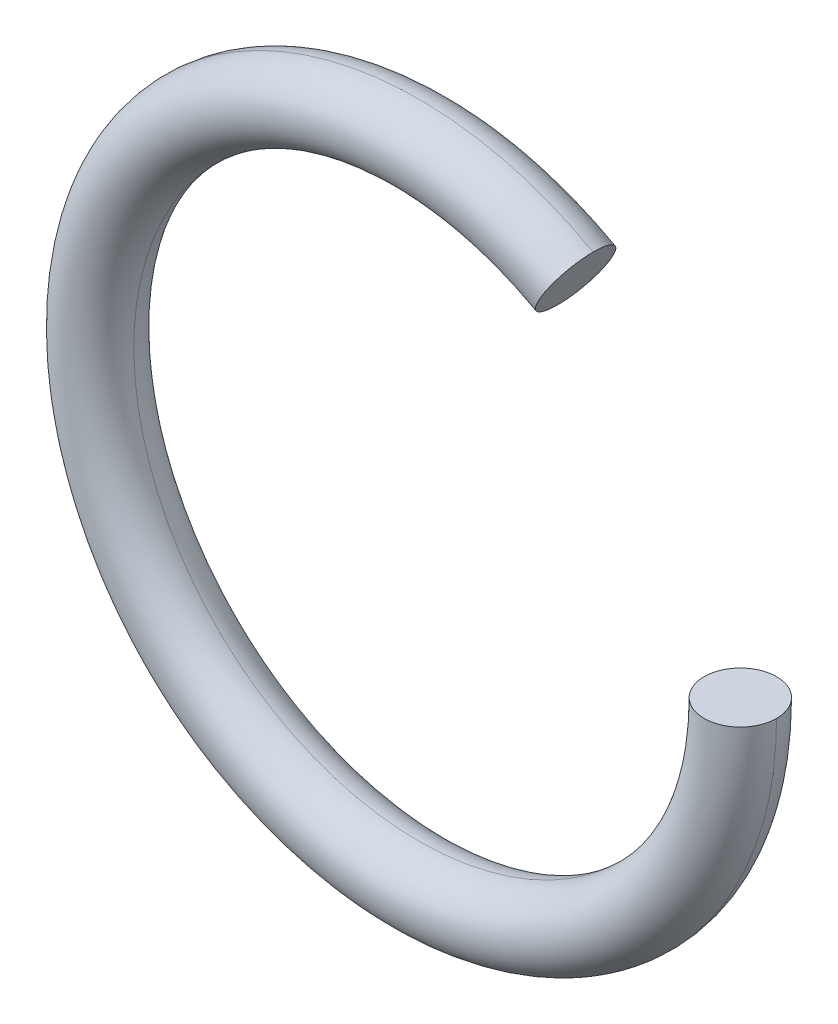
SolidWorks part; units mm, degrees
ref_plane "Front" through (0, 0, 0) normal (0, 0, 1) x (1, 0, 0)
ref_plane "Top" through (0, 0, 0) normal (0, 1, 0) x (1, 0, 0)
ref_plane "Right" through (0, 0, 0) normal (1, 0, 0) x (0, 0, -1)
other "Configuration Table"
sketch "Sketch1" plane through (0, 0, 0) normal (0, 0, 1) x (1, 0, 0)
  line L0 (0, 0) -> (28.3513, 0) construction
  line L1 (0, 0) -> (0, 38.0466) construction
  line L2 (0, 0) -> (3.5614, 6.3826) construction
  arc A0 (1.9247, 3.4494) -> (3.95, 0) centre (0, 0) ccw
  dimension "d5" = 7.9
  dimension "e" = 4
sketch "Sketch2" plane through (0, 0, 0) normal (0, 1, 0) x (1, 0, 0)
  circle A0 centre (3.55, 0) radius 0.4
  point P2 (3.95, 0)
  dimension "d4" = 0.8
sweep "Sweep1" add profiles "Sketch2" path "Sketch1"
